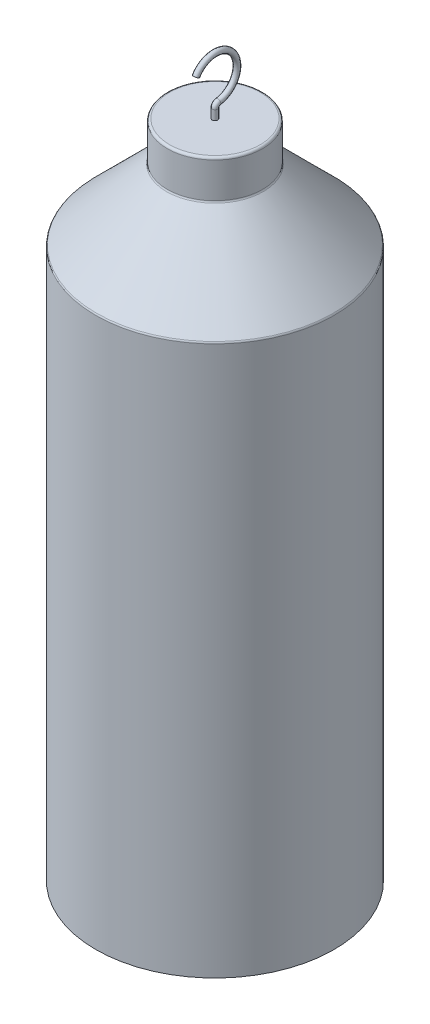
SolidWorks part; units mm, degrees
ref_plane "Спереди" through (0, 0, 0) normal (0, 0, 1) x (1, 0, 0)
ref_plane "Сверху" through (0, 0, 0) normal (0, 1, 0) x (1, 0, 0)
ref_plane "Справа" through (0, 0, 0) normal (1, 0, 0) x (0, 0, -1)
sketch "Эскиз1" plane through (0, 0, 0) normal (1, 0, 0) x (0, 0, -1)
  line L0 (0, 0) -> (32.5, 0)
  line L1 (32.5, 0) -> (32.5, 149.737)
  line L2 (32.314, 150.186) -> (13.186, 169.314)
  line L3 (13, 169.763) -> (13, 179.365)
  line L4 (12.365, 180) -> (0.75, 180)
  line L5 (0.75, 180) -> (0.75, 169.5)
  line L6 (0.75, 169.5) -> (0, 169.5)
  line L7 (0, 169.5) -> (0, 0)
  arc A0 (32.5, 149.737) -> (32.314, 150.186) centre (31.865, 149.737) ccw
  arc A1 (13.186, 169.314) -> (13, 169.763) centre (13.635, 169.763) cw
  arc A2 (13, 179.365) -> (12.365, 180) centre (12.365, 179.365) ccw
  point P11 (32.5, 150)
  point P14 (13, 169.5)
  dimension "D8" = 0.635
  dimension "D1" = 32.5
  dimension "D2" = 150
  dimension "D3" = 13
  dimension "D4" = 180
  dimension "D5" = 45
  dimension "D6" = 0.75
  dimension "D7" = 169.5
revolve "Повернуть1" add sketch "Эскиз1" angle 360 about L7
sketch "Эскиз2" plane through (0, 0, 0) normal (1, 0, 0) x (0, 0, -1)
  line L0 (0, 162.5091) -> (0, 273.8171) construction
  line L1 (0, 169.5) -> (0, 182.5718)
  line L2 (12.365, 180) -> (-12.365, 180) construction
  line L3 (0, 189.5) -> (-5.1962, 192.5) construction
  line L4 (0, 189.5) -> (-6, 189.5) construction
  arc A0 (0.8571, 183.5615) -> (-5.1962, 192.5) centre (0, 189.5) ccw
  arc A1 (0, 182.5718) -> (0.8571, 183.5615) centre (1, 182.5718) cw
  point P12 (0, 183.5)
  dimension "D3" = 12
  dimension "D5" = 1
  dimension "D1" = 10.5
  dimension "D2" = 14
  dimension "D4" = 30
ref_plane "Плоскость1" through (0, 169.5, 0) normal (0, 1, 0) x (-1, 0, 0)
sketch "Эскиз3" plane through (0, 169.5, 0) normal (0, 1, 0) x (-1, 0, 0)
  circle A0 centre (0, 0) radius 0.75
  dimension "D1" = 1.5
sweep "По траектории1" add profiles "Эскиз3" path "Эскиз2"
